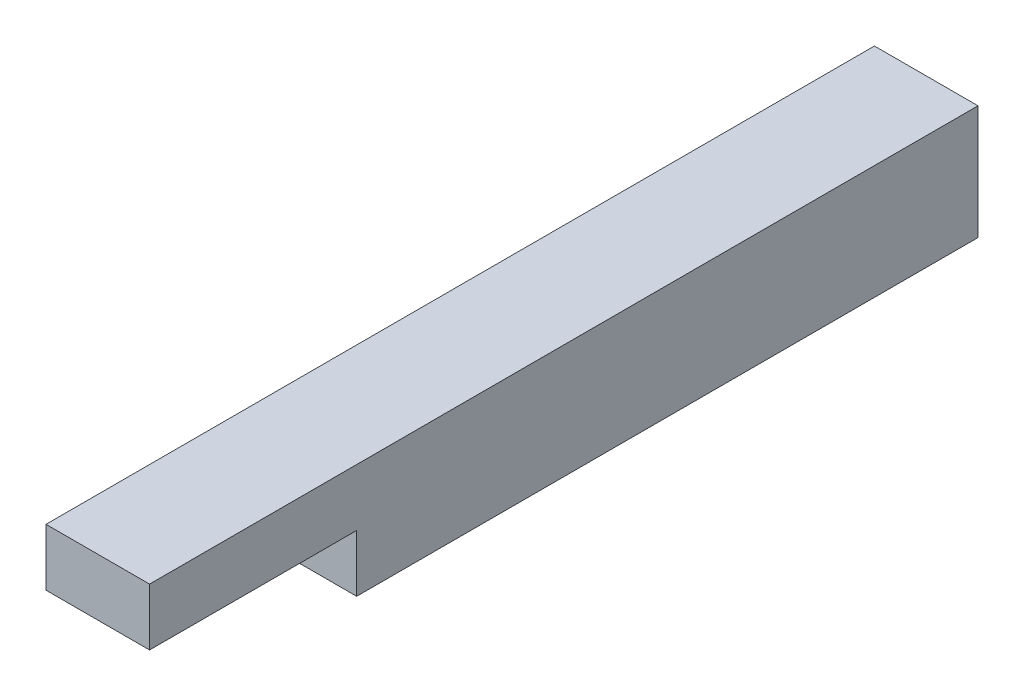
SolidWorks part; units mm, degrees
ref_plane "Front Plane" through (0, 0, 0) normal (0, 0, 1) x (1, 0, 0)
ref_plane "Top Plane" through (0, 0, 0) normal (0, 1, 0) x (1, 0, 0)
ref_plane "Right Plane" through (0, 0, 0) normal (1, 0, 0) x (0, 0, -1)
sketch "Sketch1" plane through (0, 0, 0) normal (1, 0, 0) x (0, 0, -1)
  line L0 (-50.8, 7) -> (0, 7)
  line L1 (0, 0) -> (-38.1, 0)
  line L2 (0, 0) -> (0, 7)
  line L4 (-38.1, 0) -> (-38.1, 3.5)
  line L5 (-50.8, 7) -> (-50.8, 3.5)
  line L6 (-50.8, 3.5) -> (-38.1, 3.5)
  point P5 (0, 3.5)
  dimension "D1" = 7
  dimension "D2" = 38.1
  dimension "D3" = 12.7
extrude "Boss-Extrude1" add sketch "Sketch1" along normal blind 6.35
sketch "Sketch2" plane through (0, 7, 0) normal (0, 1, 0) x (1, 0, 0)
  line L1 (6.35, -50.8) -> (0, -50.8) construction
  circle A0 centre (3.175, -44.45) radius 1.5875
  point P7 (3.175, -50.8)
  dimension "D1" = 3.175
  dimension "D2" = 6.35
extrude "Cut-Extrude1" [suppressed] cut sketch "Sketch2" against normal through all
sketch "Sketch3" plane through (0, 7, 0) normal (0, 1, 0) x (1, 0, 0)
  line L0 (0, 0) -> (0, -50.8) construction
  line L1 (0, -35.56) -> (2.54, -35.56)
  line L2 (0, -35.56) -> (0, -33.02)
  line L3 (0, -33.02) -> (2.54, -33.02)
  line L4 (2.54, -35.56) -> (2.54, -33.02)
  line L5 (6.35, -50.8) -> (0, -50.8) construction
  line L6 (0, -20.32) -> (2.54, -20.32)
  line L7 (0, -20.32) -> (0, -17.78)
  line L8 (0, -17.78) -> (2.54, -17.78)
  line L9 (2.54, -20.32) -> (2.54, -17.78)
  dimension "D1" = 2.54
  dimension "D2" = 2.54
  dimension "D3" = 2.54
  dimension "D4" = 2.54
  dimension "D5" = 15.24
  dimension "D6" = 12.7
extrude "Boss-Extrude2" [suppressed] add sketch "Sketch3" along normal blind 2.54
sketch "Sketch4" [suppressed] plane through (0, 9.54, 0) normal (0, 1, 0) x (1, 0, 0)
  line L0 (0, -35.56) -> (2.54, -35.56) construction
  line L1 (0, -17.78) -> (6.35, -17.78)
  line L2 (0, -17.78) -> (0, -20.32)
  line L3 (0, -20.32) -> (6.35, -20.32)
  line L4 (6.35, -17.78) -> (6.35, -20.32)
  line L5 (0, -33.02) -> (6.35, -33.02)
  line L6 (0, -33.02) -> (0, -35.56)
  line L7 (0, -35.56) -> (6.35, -35.56)
  line L8 (6.35, -33.02) -> (6.35, -35.56)
  line L9 (0, -20.32) -> (2.54, -20.32) construction
  line L10 (6.35, 0) -> (6.35, -50.8) construction
extrude "Boss-Extrude3" [suppressed] add sketch "Sketch4" along normal blind 2.54
